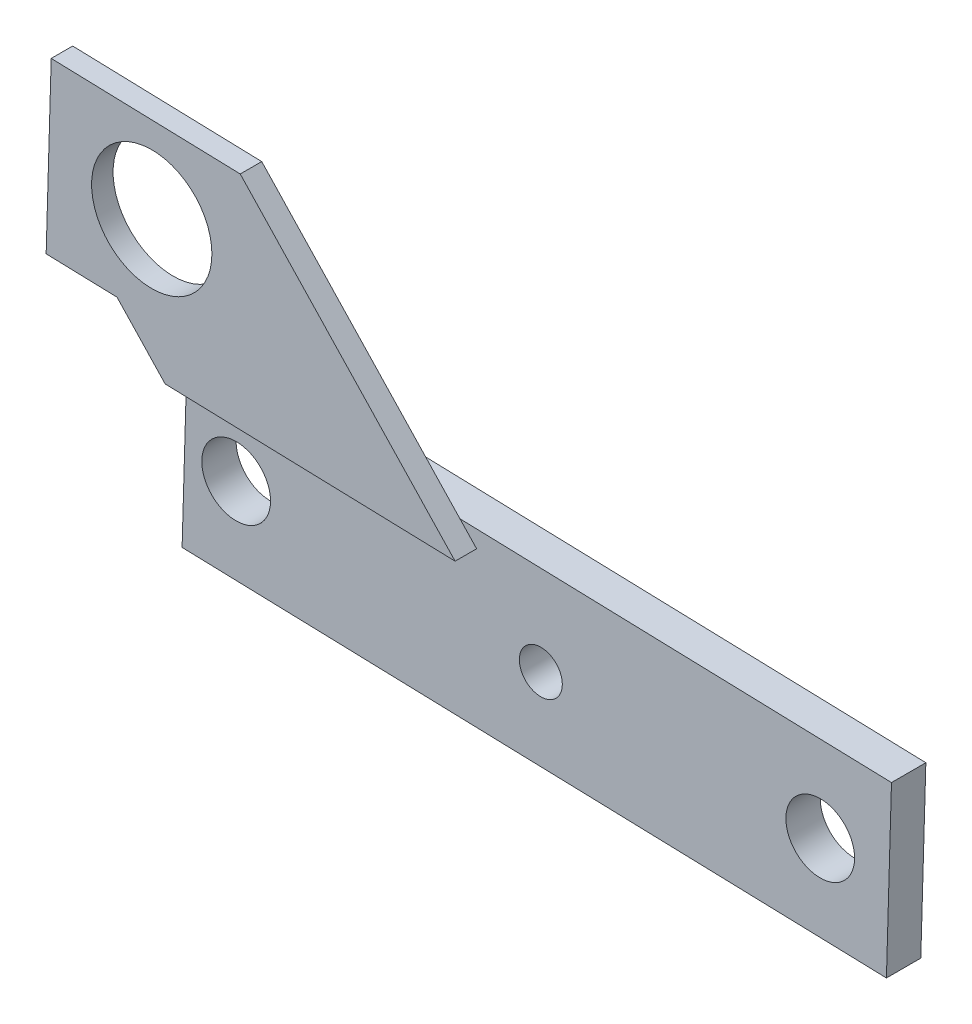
SolidWorks part; units mm, degrees
ref_plane "Plan1" through (0, 0, 0) normal (0, 0, 1) x (1, 0, 0)
ref_plane "Plan2" through (0, 0, 0) normal (0, 1, 0) x (1, 0, 0)
ref_plane "Plan3" through (0, 0, 0) normal (1, 0, 0) x (0, 0, -1)
sketch "Esquisse1" plane through (0, 0, 0) normal (0, 0, 1) x (1, 0, 0)
  line L0 (41.7923, -8.1198) -> (0.81, -6.9139)
  line L1 (41.7923, -8.1198) -> (41.4981, -18.1155)
  line L2 (0.81, -6.9139) -> (0.5159, -16.9096)
  line L3 (41.4981, -18.1155) -> (0.5159, -16.9096)
  circle A0 centre (37.6469, -13) radius 2
  circle A1 centre (21.3892, -12.75) radius 1.25
  circle A2 centre (37.6469, -13) radius 2 construction
  circle A3 centre (3.6616, -12) radius 2
  circle A4 centre (3.6616, -12) radius 2 construction
  circle A5 centre (21.3892, -12.75) radius 1.25 construction
  dimension "D1" = 4
  dimension "D2" = 41
  dimension "D3" = 10
  dimension "D4" = 5
  dimension "D5" = 5
extrude "Base-Extrusion" add sketch "Esquisse1" along normal blind 2
sketch "Esquisse2" plane through (0, 0, 0) normal (0, 0, -1) x (-1, 0, 0)
  circle A0 centre (-21.3892, -12.75) radius 2.5
  circle A1 centre (-21.3892, -12.75) radius 1.25
  circle A2 centre (-21.3892, -12.75) radius 1.25 construction
  dimension "D1" = 5
extrude "Boss.-Extru.1" add sketch "Esquisse2" along normal up to surface (2.45 mm away)
sketch "Esquisse3" plane through (0, 0, 2) normal (0, 0, 1) x (1, 0, 0)
  line L0 (-5.8503, 5.1743) -> (5.1497, 4.8506)
  line L1 (-5.8503, 5.1743) -> (-6.1445, -4.8214)
  line L2 (-6.1445, -4.8214) -> (-2.0204, -4.9427)
  line L3 (41.7923, -8.1198) -> (0.81, -6.9139) construction
  line L4 (5.1497, 4.8506) -> (17.6522, -8.4099)
  line L5 (-2.0204, -4.9427) -> (0.7806, -7.9135)
  line L6 (0.7806, -7.9135) -> (17.6522, -8.4099)
  line L7 (0.81, -6.9139) -> (0.5159, -16.9096) construction
  circle A1 centre (0, 0) radius 3.5
  dimension "D7" = 7
  dimension "D1" = 5
  dimension "D2" = 10
  dimension "D3" = 6
  dimension "D4" = 1
  dimension "D5" = 45
  dimension "D6" = 11
extrude "Boss.-Extru.2" add sketch "Esquisse3" along normal blind 1.25
